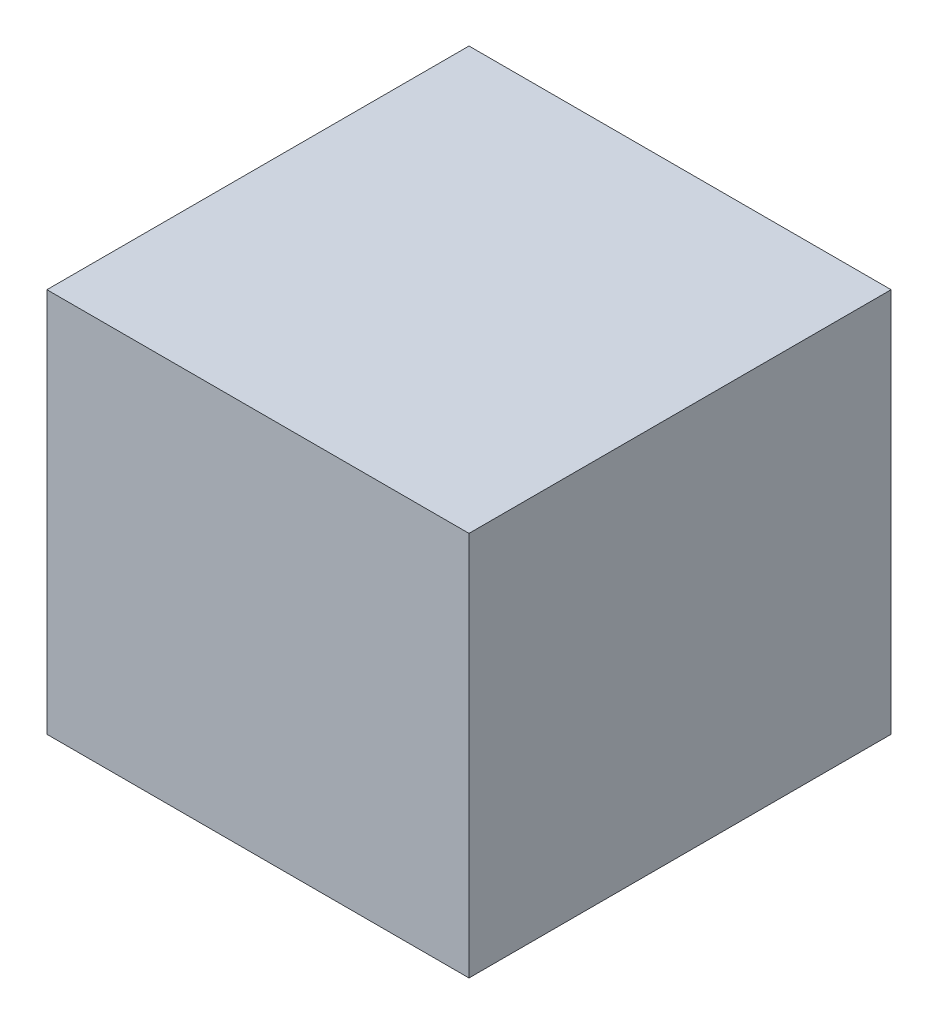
SolidWorks part; units mm, degrees
ref_plane "Front" through (0, 0, 0) normal (0, 0, 1) x (1, 0, 0)
ref_plane "Top" through (0, 0, 0) normal (0, 1, 0) x (1, 0, 0)
ref_plane "Right" through (0, 0, 0) normal (1, 0, 0) x (0, 0, -1)
sketch "Sketch1" plane through (0, 0, 0) normal (0, 1, 0) x (1, 0, 0)
  line L1 (0, 0) -> (57, 0)
  line L2 (0, 0) -> (0, 57)
  line L3 (0, 57) -> (57, 57)
  line L4 (57, 0) -> (57, 57)
  dimension "D1" = 57
extrude "Extrude1" add sketch "Sketch1" against normal blind 52
